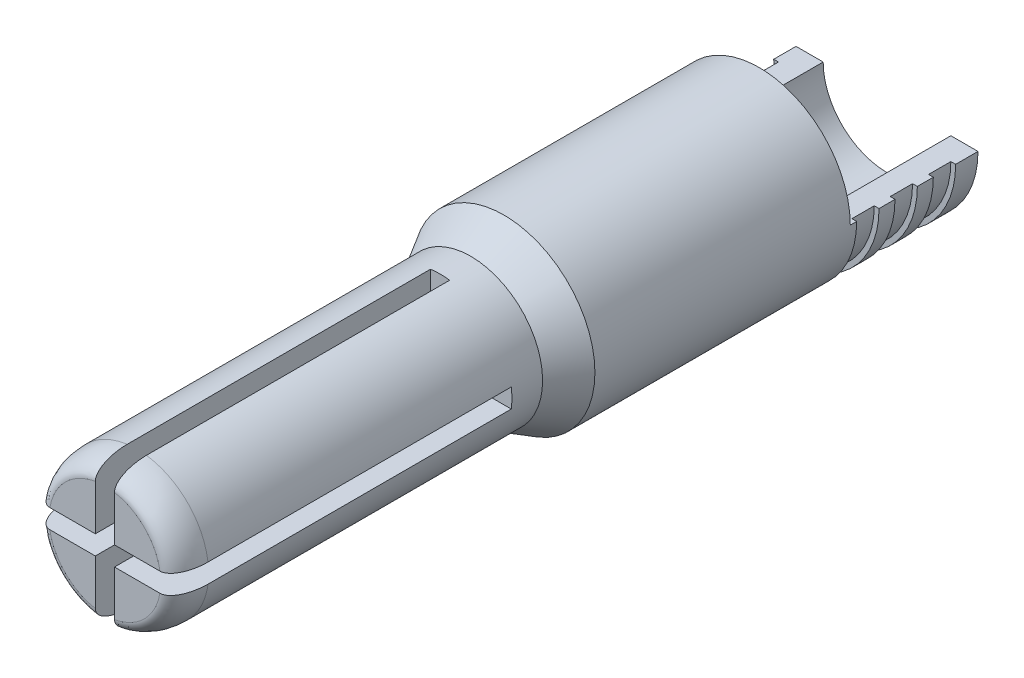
SolidWorks part; units mm, degrees
ref_plane "Спереди" through (0, 0, 0) normal (0, 0, 1) x (1, 0, 0)
ref_plane "Сверху" through (0, 0, 0) normal (0, 1, 0) x (1, 0, 0)
ref_plane "Справа" through (0, 0, 0) normal (1, 0, 0) x (0, 0, -1)
sketch "Эскиз1" plane through (0, 0, 0) normal (0, 0, 1) x (1, 0, 0)
  circle A0 centre (0, 0) radius 2.85
  dimension "D1" = 5.7
extrude "Бобышка-Вытянуть1" add sketch "Эскиз1" along normal blind 12
sketch "Эскиз2" plane through (0, 0, 12) normal (0, 0, 1) x (1, 0, 0)
  circle A0 centre (0, 0) radius 2.25
  dimension "D1" = 4.5
extrude "Бобышка-Вытянуть2" add sketch "Эскиз2" along normal blind 12.5
sketch "Эскиз3" plane through (0, 0, 0) normal (0, 0, -1) x (-1, 0, 0)
  circle A0 centre (0, 0) radius 2
  dimension "D1" = 4
extrude "Вырез-Вытянуть1" cut sketch "Эскиз3" against normal blind 12
chamfer "Фаска1" distance 1.5 angle 20 1 edges at (-2, 0, 12)
sketch "Эскиз4" plane through (0, 0, 0) normal (1, 0, 0) x (0, 0, -1)
  line L0 (0, -2.85) -> (0, 2.85) construction
  line L1 (2.3755, 4.1937) -> (-4, 4.1937)
  line L2 (2.3755, 4.1937) -> (2.3755, 0)
  line L3 (2.3755, 0) -> (-4, 0)
  line L4 (-4, 4.1937) -> (-4, 0)
  dimension "D1" = 4.1937
  dimension "D2" = 6.3755
  dimension "D3" = 4
extrude "Вырез-Вытянуть2" cut sketch "Эскиз4" against normal through all both and the other way through all
sketch "Эскиз5" plane through (0, 0, 0) normal (1, 0, 0) x (0, 0, -1)
  line L0 (0, 0) -> (-8.7729, 0) construction
  line L1 (-12, -2.85) -> (0, -2.85) construction
  line L2 (-1.4, -2.7) -> (-0.7, -2.7)
  line L3 (-1.4, -2.7) -> (-1.4, -3)
  line L4 (-1.4, -3) -> (-0.7, -3)
  line L5 (-0.7, -2.7) -> (-0.7, -3)
  line L6 (-1.05, -3) -> (-1.05, -2.7) construction
  line L7 (-1.4, -2.85) -> (-0.7, -2.85) construction
  line L8 (0, -2.85) -> (0, 0) construction
  line L9 (-2.6, -2.7) -> (-2.6, -3)
  line L10 (-2.6, -2.7) -> (-1.9, -2.7)
  line L11 (-1.9, -2.7) -> (-1.9, -3)
  line L12 (-2.6, -3) -> (-1.9, -3)
  line L13 (-3.8, -2.7) -> (-3.8, -3)
  line L14 (-3.8, -2.7) -> (-3.1, -2.7)
  line L15 (-3.1, -2.7) -> (-3.1, -3)
  line L16 (-3.8, -3) -> (-3.1, -3)
  point P3 (-1.05, -2.85)
  dimension "D1" = 0.3
  dimension "D2" = 0.7
  dimension "D3" = 0.7
  dimension "D4" = 3
revolve "Вырез-Повернуть1" cut sketch "Эскиз5" angle 360 about L0
chamfer "Фаска2" distance 0.6 angle 60 1 edges at (2.25, 0, 12)
sketch "Эскиз6" plane through (0, 0, 24.5) normal (0, 0, 1) x (1, 0, 0)
  line L1 (-0.3, -2.5) -> (0.3, -2.5)
  line L2 (-0.3, -2.5) -> (-0.3, 2.5)
  line L3 (-0.3, 2.5) -> (0.3, 2.5)
  line L4 (0.3, -2.5) -> (0.3, 2.5)
  line L5 (0, 2.5) -> (0, -2.5) construction
  line L6 (-0.3, 0) -> (0.3, 0) construction
  line L7 (-2.5, 0.3) -> (2.5, 0.3)
  line L8 (-2.5, 0.3) -> (-2.5, -0.3)
  line L9 (-2.5, -0.3) -> (2.5, -0.3)
  line L10 (2.5, 0.3) -> (2.5, -0.3)
  line L11 (0, -0.3) -> (0, 0.3) construction
  line L12 (-2.5, 0) -> (2.5, 0) construction
  point P0 (0, 0)
  point P4 (0, 0)
  dimension "D1" = 5
  dimension "D2" = 0.6
  dimension "D3" = 0.6
  dimension "D4" = 5
extrude "Вырез-Вытянуть3" cut sketch "Эскиз6" against normal blind 10.5 contours L2 L1 L4 L3 | L8 L7 L10 L9
fillet "Скругление1" radius 1 4 edges at (-1.591, 1.591, 24.5) (-1.591, -1.591, 24.5) (1.591, -1.591, 24.5) (1.591, 1.591, 24.5)
